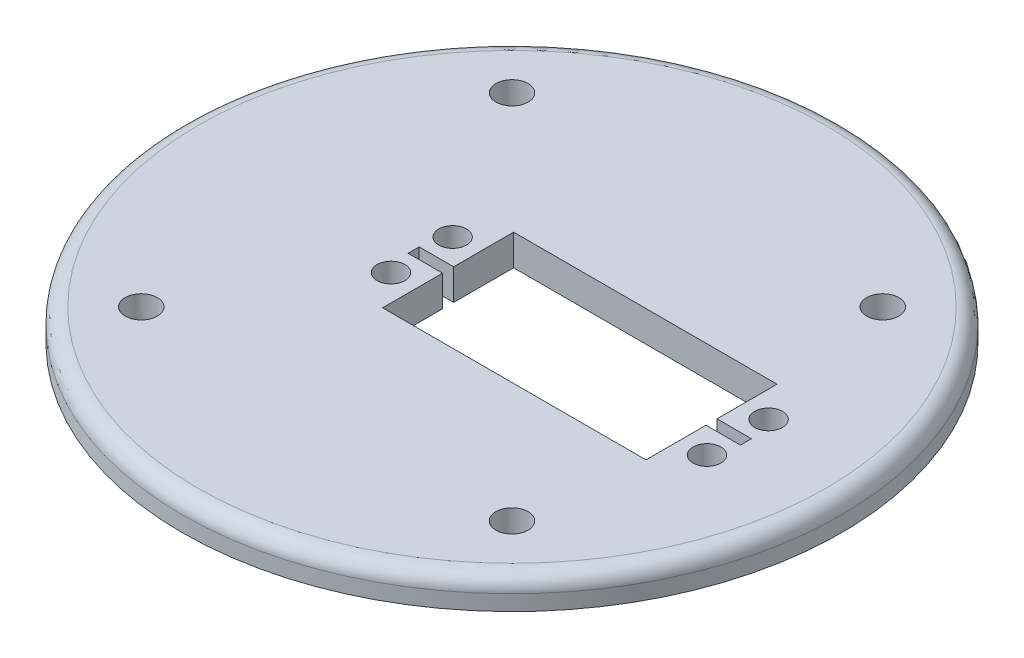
SolidWorks part; units mm, degrees
ref_plane "Front Plane" through (0, 0, 0) normal (0, 0, 1) x (1, 0, 0)
ref_plane "Top Plane" through (0, 0, 0) normal (0, 1, 0) x (1, 0, 0)
ref_plane "Right Plane" through (0, 0, 0) normal (1, 0, 0) x (0, 0, -1)
sketch "Sketch1" plane through (0, 0, 0) normal (0, 1, 0) x (1, 0, 0)
  line L0 (-9.75, 0) -> (30.65, 0) construction
  line L5 (-9.75, 10) -> (30.65, 10)
  line L6 (-9.75, 10) -> (-9.75, -10)
  line L7 (-9.75, -10) -> (30.65, -10)
  line L8 (30.65, 10) -> (30.65, -10)
  line L9 (-9.75, 10) -> (30.65, -10) construction
  line L10 (-9.75, -10) -> (30.65, 10) construction
  line L11 (10.45, -10) -> (10.45, 10) construction
  circle A6 centre (0, 0) radius 50.8
  circle A7 centre (0, 0) radius 3.175
  circle A8 centre (-13.9, 4.75) radius 2.15
  circle A9 centre (-13.9, -4.75) radius 2.15
  circle A10 centre (34.8, -4.75) radius 2.15
  circle A11 centre (34.8, 4.75) radius 2.15
  point P2 (10.45, 0)
  dimension "D1" = 101.6
  dimension "D2" = 30.65
  dimension "D7" = 24.35
  dimension "D5" = 6.35
  dimension "D6" = 4.3
  dimension "D3" = 40.4
  dimension "D4" = 20
  dimension "D8" = 9.5
extrude "Boss-Extrude1" add sketch "Sketch1" along normal blind 4.7625 contours A6 A9 A8 L5 L8 L7 L6 A10 A11
sketch "Sketch2" plane through (0, 4.7625, 0) normal (0, 1, 0) x (1, 0, 0)
  line L0 (-9.75, 0) -> (30.65, 0) construction
  line L1 (-9.75, 10) -> (-9.75, -10) construction
  line L2 (30.65, 10) -> (30.65, -10) construction
  line L3 (10.45, 0) -> (10.45, 10) construction
  line L4 (-15.16, 0.85) -> (-9.75, 0.85)
  line L5 (-15.16, 0.85) -> (-15.16, -0.85)
  line L6 (-15.16, -0.85) -> (-9.75, -0.85)
  line L7 (-9.75, 0.85) -> (-9.75, -0.85)
  line L8 (-15.16, 0.85) -> (-9.75, -0.85) construction
  line L9 (-15.16, -0.85) -> (-9.75, 0.85) construction
  line L10 (-9.75, 10) -> (30.65, 10) construction
  line L11 (30.65, 0.85) -> (30.65, -0.85)
  line L12 (36.06, 0.85) -> (30.65, 0.85)
  line L13 (36.06, -0.85) -> (30.65, -0.85)
  line L14 (36.06, 0.85) -> (36.06, -0.85)
  point P6 (-12.455, 0)
  point P15 (-9.75, 0)
  dimension "D1" = 1.7
  dimension "D2" = 5.41
  dimension "D3" = 20.2
extrude "Cut-Extrude1" cut sketch "Sketch2" against normal through all
sketch "Sketch3" plane through (0, 4.7625, 0) normal (0, 1, 0) x (1, 0, 0)
  line L1 (-28.575, 28.575) -> (28.575, 28.575) construction
  line L2 (-28.575, 28.575) -> (-28.575, -28.575) construction
  line L3 (-28.575, -28.575) -> (28.575, -28.575) construction
  line L4 (28.575, 28.575) -> (28.575, -28.575) construction
  line L5 (-28.575, 28.575) -> (28.575, -28.575) construction
  line L6 (-28.575, -28.575) -> (28.575, 28.575) construction
  circle A0 centre (-28.575, 28.575) radius 2.4812
  circle A1 centre (28.575, 28.575) radius 2.4812
  circle A2 centre (-28.575, -28.575) radius 2.4812
  circle A3 centre (28.575, -28.575) radius 2.4812
  point P0 (0, 0)
  dimension "D1" = 4.9625
  dimension "D2" = 57.15
extrude "Cut-Extrude2" cut sketch "Sketch3" against normal through all
fillet "Fillet1" radius 2.3813 1 edges at (0, 4.7625, 50.8)
sketch "Sketch4" plane through (0, 4.7625, 0) normal (0, 1, 0) x (1, 0, 0)
  line L0 (-9.75, 10) -> (30.65, 10) construction
  line L1 (-9.85, 10.1) -> (30.75, 10.1)
  line L2 (-9.85, 10.1) -> (-9.85, -10.1)
  line L3 (-9.85, -10.1) -> (30.75, -10.1)
  line L4 (30.75, 10.1) -> (30.75, -10.1)
  line L5 (-9.85, 10.1) -> (30.75, -10.1) construction
  line L6 (-9.85, -10.1) -> (30.75, 10.1) construction
  line L7 (-9.75, -10) -> (30.65, -10) construction
  line L8 (-9.75, 10) -> (-9.75, 0.85) construction
  line L9 (30.65, -0.85) -> (30.65, -10) construction
  point P0 (10.45, 0)
  dimension "D1" = 0.1
  dimension "D2" = 0.1
  dimension "D3" = 0.1
  dimension "D4" = 0.1
extrude "Cut-Extrude3" cut sketch "Sketch4" against normal through all
